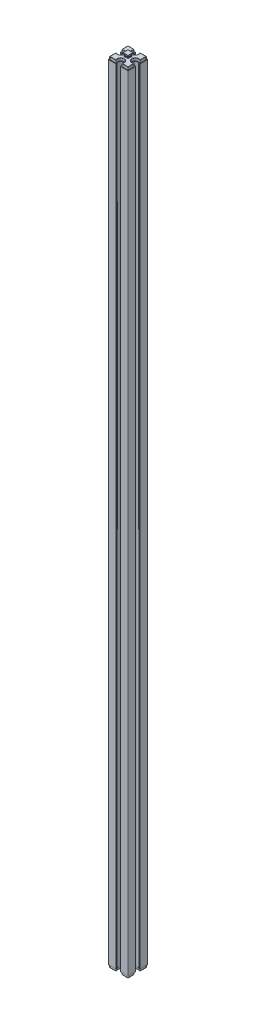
SolidWorks part; units mm, degrees
ref_plane "前视基准面" through (0, 0, 0) normal (0, 0, 1) x (1, 0, 0)
ref_plane "上视基准面" through (0, 0, 0) normal (0, 1, 0) x (1, 0, 0)
ref_plane "右视基准面" through (0, 0, 0) normal (1, 0, 0) x (0, 0, -1)
sketch "草图1" plane through (0, 0, 0) normal (0, 1, 0) x (1, 0, 0)
  line L0 (0, 0) -> (0, 7.5) construction
  line L1 (0, 0) -> (7.5, 0) construction
  line L2 (-7.5, 7.5) -> (-1.5, 7.5)
  line L3 (7.5, 7.5) -> (7.5, 1.5)
  line L4 (6.8229, 1.5) -> (7.5, 1.5)
  line L5 (6.8229, -1.5) -> (7.5, -1.5)
  line L6 (0, 7.5) -> (0, 5.5) construction
  line L7 (-1.5, 6.8229) -> (-1.5, 7.5)
  line L8 (1.5, 6.8229) -> (1.5, 7.5)
  line L9 (1.5, 7.5) -> (7.5, 7.5)
  line L10 (7.5, -1.5) -> (7.5, -7.5)
  line L11 (7.5, -7.5) -> (1.5, -7.5)
  line L12 (1.5, -6.8229) -> (1.5, -7.5)
  line L13 (-1.5, -6.8229) -> (-1.5, -7.5)
  line L14 (-1.5, -7.5) -> (-7.5, -7.5)
  line L15 (-7.5, -7.5) -> (-7.5, -1.5)
  line L16 (-6.8229, -1.5) -> (-7.5, -1.5)
  line L17 (-6.8229, 1.5) -> (-7.5, 1.5)
  line L18 (-7.5, 1.5) -> (-7.5, 7.5)
  arc A0 (-1.5, 6.8229) -> (1.5, 6.8229) centre (0, 5.5) ccw
  arc A1 (6.8229, 1.5) -> (6.8229, -1.5) centre (5.5, 0) ccw
  arc A2 (1.5, -6.8229) -> (-1.5, -6.8229) centre (0, -5.5) ccw
  arc A3 (-6.8229, -1.5) -> (-6.8229, 1.5) centre (-5.5, 0) ccw
  point P36 (0, 0)
  dimension "D6" = 4
  dimension "D7" = 2
  dimension "D1" = 7.5
  dimension "D2" = 7.5
  dimension "D3" = 2
  dimension "D4" = 7.5
  dimension "D5" = 1.5
extrude "凸台-拉伸1" add sketch "草图1" along normal blind 298
sketch "草图2" plane through (0, 298, 0) normal (0, 1, 0) x (1, 0, 0)
  line L0 (-7, 7) -> (-7, 2)
  line L1 (-7, 2) -> (-7, 2)
  line L2 (-7, -2) -> (-7, -2)
  line L3 (-7, -2) -> (-7, -7)
  line L4 (-7, -7) -> (-2, -7)
  line L5 (-2, -7) -> (-2, -7)
  line L6 (2, -7) -> (2, -7)
  line L7 (2, -7) -> (7, -7)
  line L8 (7, -7) -> (7, -2)
  line L9 (7, -2) -> (7, -2)
  line L10 (7, 2) -> (7, 2)
  line L11 (7, 2) -> (7, 7)
  line L12 (7, 7) -> (2, 7)
  line L13 (2, 7) -> (2, 7)
  line L14 (-2, 7) -> (-2, 7)
  line L15 (-2, 7) -> (-7, 7)
  line L16 (-7.5, 7.5) -> (-7.5, 1.5)
  line L17 (-7.5, 1.5) -> (-6.8229, 1.5)
  line L18 (-6.8229, -1.5) -> (-7.5, -1.5)
  line L19 (-7.5, -1.5) -> (-7.5, -7.5)
  line L20 (-7.5, -7.5) -> (-1.5, -7.5)
  line L21 (-1.5, -7.5) -> (-1.5, -6.8229)
  line L22 (1.5, -6.8229) -> (1.5, -7.5)
  line L23 (1.5, -7.5) -> (7.5, -7.5)
  line L24 (7.5, -7.5) -> (7.5, -1.5)
  line L25 (7.5, -1.5) -> (6.8229, -1.5)
  line L26 (6.8229, 1.5) -> (7.5, 1.5)
  line L27 (7.5, 1.5) -> (7.5, 7.5)
  line L28 (7.5, 7.5) -> (1.5, 7.5)
  line L29 (1.5, 7.5) -> (1.5, 6.8229)
  line L30 (-1.5, 6.8229) -> (-1.5, 7.5)
  line L31 (-1.5, 7.5) -> (-7.5, 7.5)
  line L32 (-7.5, 7.5) -> (-7.5, 1.5) construction
  line L33 (-7.5, 1.5) -> (-6.8229, 1.5) construction
  line L34 (-6.8229, -1.5) -> (-7.5, -1.5) construction
  line L35 (-7.5, -1.5) -> (-7.5, -7.5) construction
  line L36 (-7.5, -7.5) -> (-1.5, -7.5) construction
  line L37 (-1.5, -7.5) -> (-1.5, -6.8229) construction
  line L38 (1.5, -6.8229) -> (1.5, -7.5) construction
  line L39 (1.5, -7.5) -> (7.5, -7.5) construction
  line L40 (7.5, -7.5) -> (7.5, -1.5) construction
  line L41 (7.5, -1.5) -> (6.8229, -1.5) construction
  line L42 (6.8229, 1.5) -> (7.5, 1.5) construction
  line L43 (7.5, 1.5) -> (7.5, 7.5) construction
  line L44 (7.5, 7.5) -> (1.5, 7.5) construction
  line L45 (1.5, 7.5) -> (1.5, 6.8229) construction
  line L46 (-1.5, 6.8229) -> (-1.5, 7.5) construction
  line L47 (-1.5, 7.5) -> (-7.5, 7.5) construction
  arc A0 (-7, -2) -> (-7, 2) centre (-5.5, 0) ccw
  arc A1 (2, -7) -> (-2, -7) centre (0, -5.5) ccw
  arc A2 (7, 2) -> (7, -2) centre (5.5, 0) ccw
  arc A3 (-2, 7) -> (2, 7) centre (0, 5.5) ccw
  arc A4 (-6.8229, -1.5) -> (-6.8229, 1.5) centre (-5.5, 0) ccw
  arc A5 (1.5, -6.8229) -> (-1.5, -6.8229) centre (0, -5.5) ccw
  arc A6 (6.8229, 1.5) -> (6.8229, -1.5) centre (5.5, 0) ccw
  arc A7 (-1.5, 6.8229) -> (1.5, 6.8229) centre (0, 5.5) ccw
  arc A8 (-6.8229, -1.5) -> (-6.8229, 1.5) centre (-5.5, 0) ccw construction
  arc A9 (1.5, -6.8229) -> (-1.5, -6.8229) centre (0, -5.5) ccw construction
  arc A10 (6.8229, 1.5) -> (6.8229, -1.5) centre (5.5, 0) ccw construction
  arc A11 (-1.5, 6.8229) -> (1.5, 6.8229) centre (0, 5.5) ccw construction
  dimension "D1" = 0
  dimension "D2" = 0.5
extrude "凸台-拉伸2" add sketch "草图2" along normal blind 2
sketch "草图3" plane through (0, 0, 0) normal (1, 0, 0) x (0, 0, -1)
  line L0 (0, 300) -> (0, 302) construction
  line L1 (2.5, 300) -> (-2.5, 300) construction
  line L2 (0, 302) -> (0, 302.5) construction
  line L3 (-1.5, 300) -> (1.5, 300)
  line L4 (1.5, 300) -> (1.5, 300.6771)
  line L5 (-1.95, 302.5) -> (1.95, 302.5)
  line L6 (1.95, 302.5) -> (1.95, 301.5556)
  line L7 (-1.5, 300) -> (-1.5, 300.6771)
  line L8 (-1.95, 302.5) -> (-1.95, 301.5556)
  arc A0 (-1.5, 300.6771) -> (-1.95, 301.5556) centre (0, 302) cw
  arc A1 (1.5, 300.6771) -> (1.95, 301.5556) centre (0, 302) ccw
  dimension "D5" = 2
  dimension "D1" = 2
  dimension "D2" = 0.5
  dimension "D3" = 1.5
  dimension "D4" = 1.95
extrude "凸台-拉伸3" add sketch "草图3" along normal blind 2 and the other way blind 2
sketch "草图4" plane through (0, 0, 0) normal (0, 0, 1) x (1, 0, 0)
  line L0 (0, 300) -> (0, 302) construction
  line L2 (-2, 300) -> (2, 300) construction
  line L3 (0, 302) -> (0, 302.5) construction
  line L4 (-2, 302.5) -> (2, 302.5) construction
  line L5 (1.95, 302.5) -> (2, 302.5)
  line L6 (-1.95, 302.5) -> (-1.95, 301.5556)
  line L9 (-1.5, 300) -> (-1.5, 300.6771)
  line L10 (1.5, 300) -> (1.5, 300.6771)
  line L11 (1.95, 302.5) -> (1.95, 301.5556)
  line L12 (1.5, 300) -> (2, 300)
  line L13 (-2, 302.5) -> (-1.95, 302.5)
  line L14 (-2, 302.5) -> (-2, 300)
  line L15 (-2, 300) -> (-1.5, 300)
  line L16 (2, 302.5) -> (2, 300)
  arc A0 (-1.95, 301.5556) -> (-1.5, 300.6771) centre (0, 302) ccw
  arc A1 (1.95, 301.5556) -> (1.5, 300.6771) centre (0, 302) cw
  dimension "D1" = 2
  dimension "D2" = 1.5
  dimension "D3" = 1.95
fillet "圆角3" radius 0.2 13 edges at (-1.5, 149, -7.5) (1.5, 149, -7.5) (7.5, 149, -7.5) (7.5, 149, -1.5) (7.5, 149, 1.5) (7.5, 149, 7.5) (-1.5, 149, 7.5) (1.5, 149, 7.5) (-6.8229, 149, -1.5) (-7.5, 149, 7.5) (-7.5, 149, 1.5) (-7.5, 149, -1.5) (-7.5, 149, -7.5)
extrude "切除-拉伸1" cut sketch "草图4" against normal blind 3 and the other way blind 3
fillet "圆角4" radius 0.2 24 edges at (0, 300, 3) (-3, 300, 0) (0, 300, -3) (3, 300, 0) (7, 299, 2) (7, 299, -2) (2, 299, -7) (-2, 299, -7) (-7, 299, 2) (-7, 299, -2) (2, 299, 7) (-2, 299, 7) (7, 299, 7) (4.5, 300, 7) (7, 300, 4.5) (7, 300, -4.5) (7, 299, -7) (4.5, 300, -7) (-4.5, 300, -7) (-7, 299, -7) (-7, 300, -4.5) (-4.5, 300, 7) (-7, 300, 4.5) (-7, 299, 7)
fillet "圆角5" radius 0.1 4 edges at (0, 302.5, -1.95) (1.95, 302.5, 0) (0, 302.5, 1.95) (-1.95, 302.5, 0)
mirror "镜向1" of "圆角5", "圆角4", "切除-拉伸1", "圆角3", "凸台-拉伸3", "凸台-拉伸2", "凸台-拉伸1"
